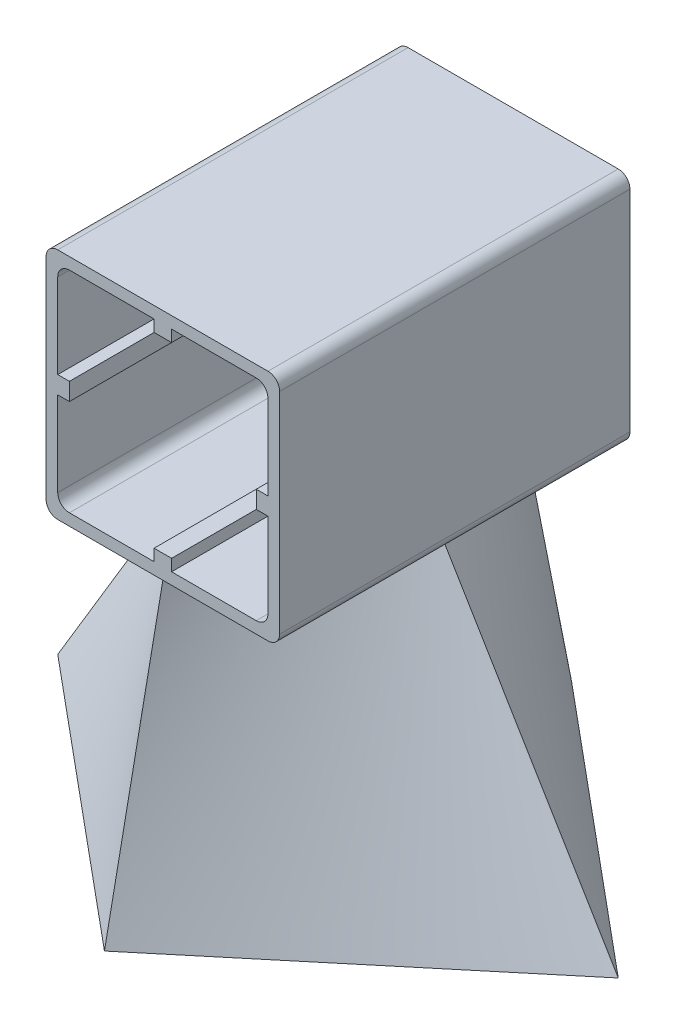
SolidWorks part; units mm, degrees
ref_plane "前视基准面" through (0, 0, 0) normal (0, 0, 1) x (1, 0, 0)
ref_plane "上视基准面" through (0, 0, 0) normal (0, 1, 0) x (1, 0, 0)
ref_plane "右视基准面" through (0, 0, 0) normal (1, 0, 0) x (0, 0, -1)
sketch "草图1" plane through (0, 0, 0) normal (0, 0, 1) x (1, 0, 0)
  line L0 (8, -0.75) -> (8, 0.75)
  line L1 (9, 10) -> (-9, 10)
  line L2 (10, 9) -> (10, -9)
  line L3 (9, -10) -> (-9, -10)
  line L4 (-10, 9) -> (-10, -9)
  line L5 (10, 10) -> (-10, -10) construction
  line L6 (10, -10) -> (-10, 10) construction
  line L7 (8, 9) -> (-8, 9)
  line L8 (9, 8) -> (9, -8)
  line L9 (8, -9) -> (-8, -9)
  line L10 (-9, 8) -> (-9, -8)
  line L11 (9, 9) -> (-9, -9) construction
  line L12 (9, -9) -> (-9, 9) construction
  line L13 (0.75, 10) -> (-0.75, 10)
  line L14 (0.75, 10) -> (0.75, 8)
  line L15 (0.75, 8) -> (-0.75, 8)
  line L16 (-0.75, 10) -> (-0.75, 8)
  line L17 (0.75, 10) -> (-0.75, 8) construction
  line L18 (0.75, 8) -> (-0.75, 10) construction
  line L19 (10, -0.75) -> (8, -0.75)
  line L20 (10, 0.75) -> (8, 0.75)
  line L21 (-0.75, -8) -> (0.75, -8)
  line L22 (-0.75, -10) -> (-0.75, -8)
  line L23 (0.75, -10) -> (0.75, -8)
  line L24 (-8, 0.75) -> (-8, -0.75)
  line L25 (-10, 0.75) -> (-8, 0.75)
  line L26 (-10, -0.75) -> (-8, -0.75)
  line L27 (-8, 0) -> (0, 0) construction
  arc A0 (-8, 9) -> (-9, 8) centre (-8, 8) ccw
  arc A1 (9, -8) -> (8, -9) centre (8, -8) cw
  arc A2 (8, 9) -> (9, 8) centre (8, 8) cw
  arc A3 (-8, -9) -> (-9, -8) centre (-8, -8) cw
  arc A4 (-9, 10) -> (-10, 9) centre (-9, 9) ccw
  arc A5 (10, -9) -> (9, -10) centre (9, -9) cw
  arc A6 (9, 10) -> (10, 9) centre (9, 9) cw
  arc A7 (-9, -10) -> (-10, -9) centre (-9, -9) cw
  point P0 (0, 0)
  point P6 (0, 0)
  point P35 (0, 9)
  point P55 (0, 0)
  dimension "D5" = 1
  dimension "D1" = 18
  dimension "D2" = 18
  dimension "D3" = 20
  dimension "D4" = 20
  dimension "D6" = 1.5
  dimension "D7" = 2
  dimension "D8" = 4
extrude "凸台-拉伸1" add sketch "草图1" along normal mid plane 30 contours L8 L20 L0 L19 | L7 L16 L15 L14 | L10 L26 L24 L25 | L4 L26 L10 L25 | L9 L23 L21 L22 | L3 L23 L9 L22 | A5 L2 L19 L8 A1 L9 L23 L3 | L2 L20 L8 L19 | A6 L1 L14 L7 A2 L8 L20 L2 | L1 A4 L4 L25 L10 A0 L7 L16 | A7 L3 L22 L9 A3 L10 L26 L4 | L1 L16 L7 L14
ref_plane "基准面1" through (0, -35, 0) normal (0, -1, 0) x (-1, 0, 0)
sketch "草图4" plane through (0, -35, 0) normal (0, -1, 0) x (-1, 0, 0)
  line L0 (24, 0) -> (0, 20)
  line L1 (24, -20) -> (-24, -20) construction
  line L2 (24, -20) -> (24, 20) construction
  line L3 (24, 20) -> (-24, 20) construction
  line L4 (-24, -20) -> (-24, 20) construction
  line L5 (24, -20) -> (-24, 20) construction
  line L6 (24, 20) -> (-24, -20) construction
  line L7 (0, 20) -> (-24, 0)
  line L8 (-24, 0) -> (0, -20)
  line L9 (0, -20) -> (24, 0)
  point P0 (0, 0)
  dimension "D1" = 40
  dimension "D2" = 48
sketch "草图5" plane through (0, -10, 0) normal (0, -1, 0) x (1, 0, 0)
  line L0 (-9, 0) -> (0, -15)
  line L1 (-9, 15) -> (-9, -15) construction
  line L2 (9, -15) -> (-9, -15) construction
  line L3 (0, -15) -> (9, 0)
  line L4 (9, 15) -> (9, -15) construction
  line L5 (9, 0) -> (0, 15)
  line L6 (9, 15) -> (-9, 15) construction
  line L7 (0, 15) -> (-9, 0)
loft "放样2" add profiles "草图4", "草图5"
